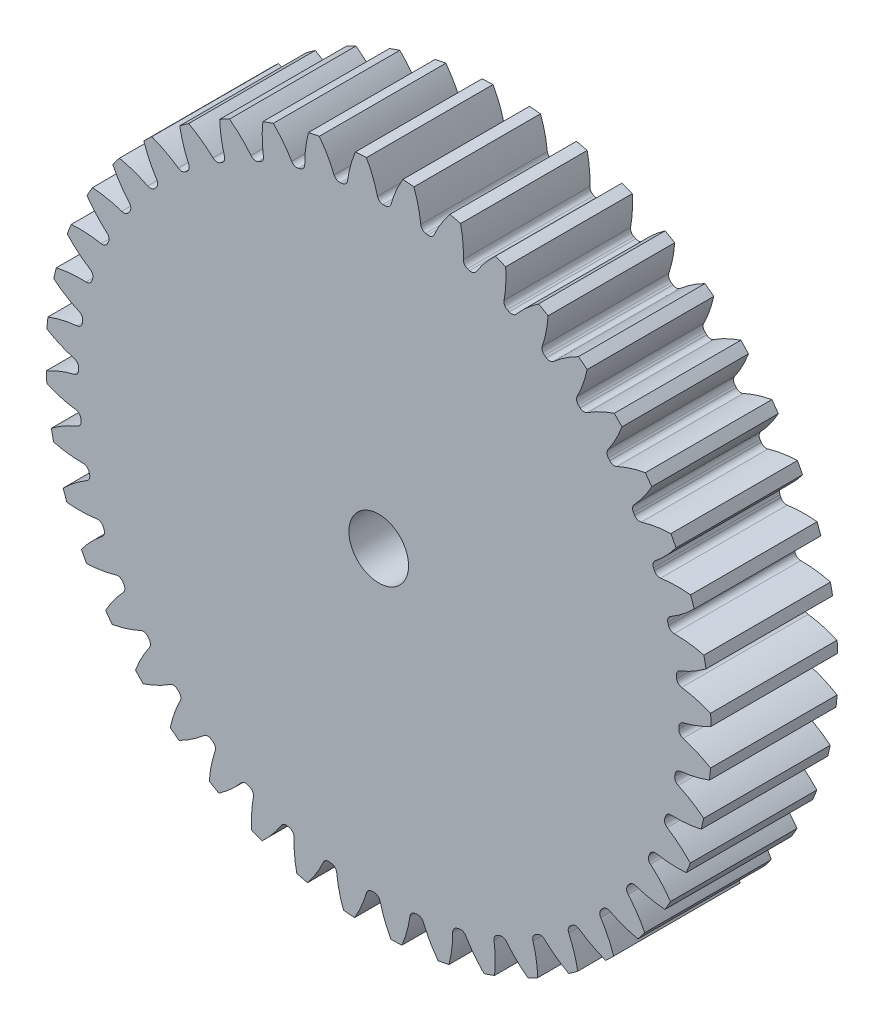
SolidWorks part; units mm, degrees
ref_plane "Front" through (0, 0, 0) normal (0, 0, 1) x (1, 0, 0)
ref_plane "Top" through (0, 0, 0) normal (0, 1, 0) x (1, 0, 0)
ref_plane "Right" through (0, 0, 0) normal (1, 0, 0) x (0, 0, -1)
sketch "Sketch3" plane through (0, 0, 0) normal (0, 0, 1) x (1, 0, 0)
  circle A0 centre (0, 0) radius 233.68
  dimension "od" = 467.36
extrude "gearBody" add sketch "Sketch3" along normal blind 88.9
sketch "Sketch2" plane through (0, 0, 0) normal (0, 0, 1) x (1, 0, 0)
  line L0 (0, 0) -> (194.0517, 80.3789) construction
  line L1 (233.2175, -17.0719) -> (0, 0) construction
  line L2 (0, 0) -> (36.3143, 0) construction
  line L3 (223.4853, 3.9377) -> (223.2, -11.9561) construction
  line L5 (223.3427, -4.0092) -> (0, 0) construction
  line L7 (0, 0) -> (210.0401, 0) construction
  arc A0 (210.0401, 0.0423) -> (209.9033, -7.5807) centre (0, 0) ccw construction
  arc A1 (233.5216, 8.6033) -> (233.0623, -16.979) centre (0, 0) ccw construction
  arc A2 (223.4853, 3.9377) -> (223.2, -11.9561) centre (0, 0) ccw construction
  arc A3 (210.7713, -4.5308) -> (210.7981, -3.0368) centre (0, 0) ccw
  arc A4 (233.2175, -17.0719) -> (213.7587, -8.5926) centre (191.0419, -87.2917) ccw
  arc A5 (233.2175, -17.0719) -> (233.68, 8.6907) centre (0, 0) ccw
  arc A6 (233.68, 8.6907) -> (213.9293, 0.9152) centre (194.0517, 80.3789) cw
  arc A7 (210.7981, -3.0368) -> (213.9293, 0.9152) centre (214.9328, -3.0963) cw
  arc A8 (213.7587, -8.5926) -> (210.7713, -4.5308) centre (214.9055, -4.6197) cw
  point P6 (233.68, 8.6907)
  point P22 (233.2175, -17.0719)
  dimension "baseDia" = 420.0802
  dimension "od" = 467.36
  dimension "pd" = 447.04
  dimension "rd" = 421.64
  dimension "rFillet" = 4.1351
  dimension "pointX" = 233.68
  dimension "pointY" = 8.6907
  dimension "CTT" = 15.8937
  dimension "flankCenterAngle" = 22.5
extrude "toothCut" cut sketch "Sketch2" along normal through all
pattern_circular "CirPattern1" count 44 over 360 about axis through (0, 0, 0) along (0, 0, 1) of "toothCut"
sketch "hub1Dia" plane through (0, 0, 0) normal (0, 0, -1) x (-1, 0, 0)
  circle A0 centre (0, 0) radius 12.7
  dimension "hub1Dia" = 25.4
sketch "hub2Dia" plane through (0, 0, 88.9) normal (0, 0, 1) x (1, 0, 0)
  circle A0 centre (0, 0) radius 12.7
  dimension "hub2dia" = 25.4
sketch "boreDia" plane through (0, 0, 0) normal (0, 0, 1) x (1, 0, 0)
  circle A0 centre (0, 0) radius 20.955
  dimension "boreDia" = 41.91
extrude "bore" cut sketch "boreDia" against normal mid plane 25400
